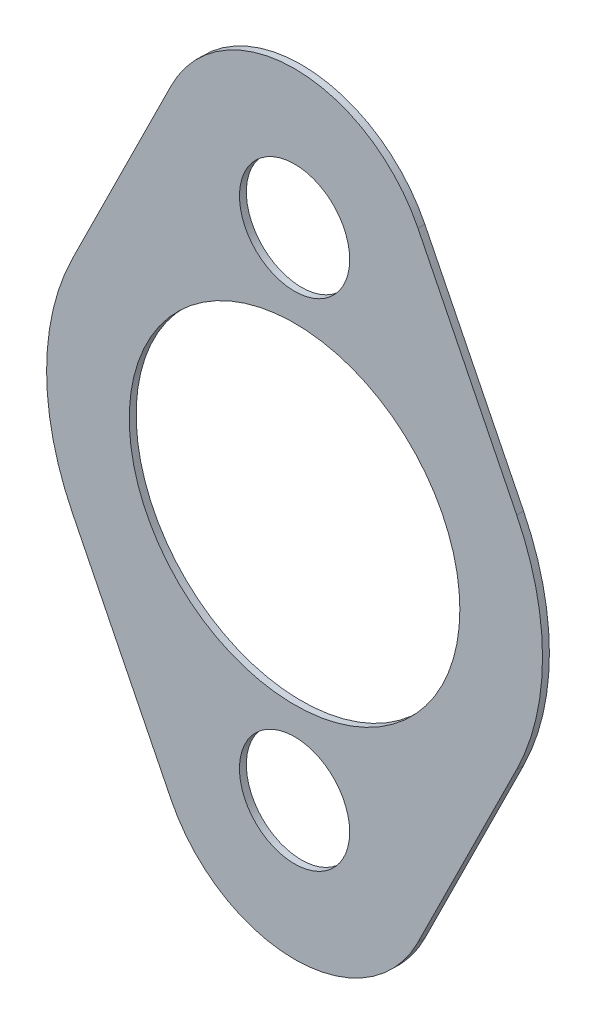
SolidWorks part; units mm, degrees
ref_plane "Front" through (0, 0, 0) normal (0, 0, 1) x (1, 0, 0)
ref_plane "Top" through (0, 0, 0) normal (0, 1, 0) x (1, 0, 0)
ref_plane "Right" through (0, 0, 0) normal (1, 0, 0) x (0, 0, -1)
sketch "Sketch1" plane through (0, 0, 0) normal (0, 0, 1) x (1, 0, 0)
  line L0 (0, 0) -> (0, 94.4945) construction
  line L1 (0, 0) -> (88.837, 0) construction
  line L2 (28.4419, 71.2611) -> (51.1953, 25.4)
  line L3 (28.4419, -71.2611) -> (51.1953, -25.4)
  line L4 (-28.4419, 71.2611) -> (-51.1953, 25.4)
  line L5 (-28.4419, -71.2611) -> (-51.1953, -25.4)
  arc A0 (-28.4419, 71.2611) -> (28.4419, 71.2611) centre (0, 57.15) cw
  arc A1 (-28.4419, -71.2611) -> (28.4419, -71.2611) centre (0, -57.15) ccw
  arc A2 (51.1953, 25.4) -> (51.1953, -25.4) centre (0, 0) cw
  arc A3 (-51.1953, -25.4) -> (-51.1953, 25.4) centre (0, 0) cw
  dimension "EndR" = 31.75
  dimension "SideR" = 57.15
  dimension "CtoC" = 114.3
extrude "Main" add sketch "Sketch1" along normal blind 1.5875
sketch "Sketch2" plane through (0, 0, 1.5875) normal (0, 0, 1) x (1, 0, 0)
  circle A0 centre (0, 57.15) radius 12.7
  circle A1 centre (0, -57.15) radius 12.7
  circle A2 centre (0, 0) radius 38.1
  dimension "BoltH" = 25.4
  dimension "CenterH" = 76.2
extrude "Holes" cut sketch "Sketch2" against normal through all
